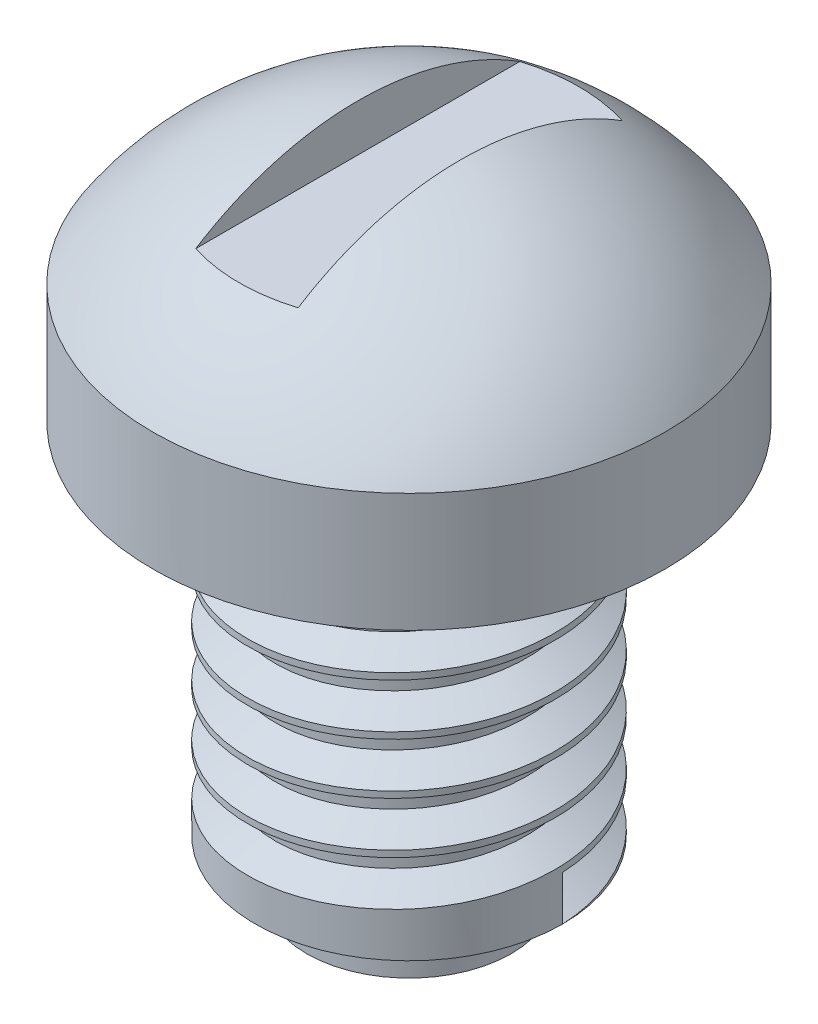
SolidWorks part; units mm, degrees
ref_plane "Front Plane" through (0, 0, 0) normal (0, 0, 1) x (1, 0, 0)
ref_plane "Top Plane" through (0, 0, 0) normal (0, 1, 0) x (1, 0, 0)
ref_plane "Right Plane" through (0, 0, 0) normal (1, 0, 0) x (0, 0, -1)
sketch "Sketch1" plane through (0, 0, 0) normal (0, 0, 1) x (1, 0, 0)
  line L0 (0, -6) -> (0, 6)
  line L2 (-5, 1) -> (-3, 1)
  line L3 (-3, 1) -> (-3, -6)
  line L4 (-3, -6) -> (0, -6)
  line L5 (-5, 1) -> (-5, 3.3166)
  arc A0 (0, 6) -> (-5, 3.3166) centre (0, 0) ccw
  point P3 (0, 0)
  point P11 (0, 0)
  dimension "D5" = 6
  dimension "D1" = 7
  dimension "D2" = 5
  dimension "D3" = 3
  dimension "D4" = 5
revolve "Revolve1" add sketch "Sketch1" angle 360 about L0
sketch "Sketch3" plane through (0, 0, 0) normal (0, 0, 1) x (1, 0, 0)
  line L0 (-1, 6) -> (-1, 5)
  line L1 (-1, 6) -> (1, 6)
  line L2 (0, 6) -> (0, 5)
  line L3 (-1, 5) -> (1, 5)
  line L4 (1, 6) -> (1, 5)
  arc A0 (5, 3.3166) -> (-5, 3.3166) centre (0, 0) ccw construction
  dimension "D1" = 1
  dimension "D2" = 1
extrude "Cut-Extrude1" cut sketch "Sketch3" against normal through all and the other way through all contours L1 L4 L3 L0
sketch "Sketch4" plane through (0, -6, 0) normal (0, -1, 0) x (1, 0, 0)
  circle A0 centre (0, 0) radius 2
  dimension "D1" = 4
extrude "Boss-Extrude1" add sketch "Sketch4" along normal blind 1
thread "Thread1" pitch 1 start angle 0, offset 0, length 0, pitch 1, diameter 6
ref_plane "Plane1" through (3, -6, 0) normal (0, 0, 1) x (1, 0, 0)
sketch "Thread Profile1" plane through (3, -6, 0) normal (0, 0, 1) x (1, 0, 0)
  line L0 (0, 0) -> (0, 1) construction
  line L11 (0, 0) -> (0, 0.875)
  line L12 (0, 0.875) -> (-0.5413, 0.5625)
  line L13 (-0.5413, 0.5625) -> (-0.5413, 0.3125)
  line L15 (-0.5413, 0.3125) -> (0, 0)
  line L17 (-0.5413, 0.4375) -> (0, 0.4375) construction
  point P2 (0, 0)
  dimension "Pitch" = 1
  dimension "Profile_Angle" = 60
  dimension "Profile_Land" = 0.25
  dimension "Profile_Height" = 0.5413
